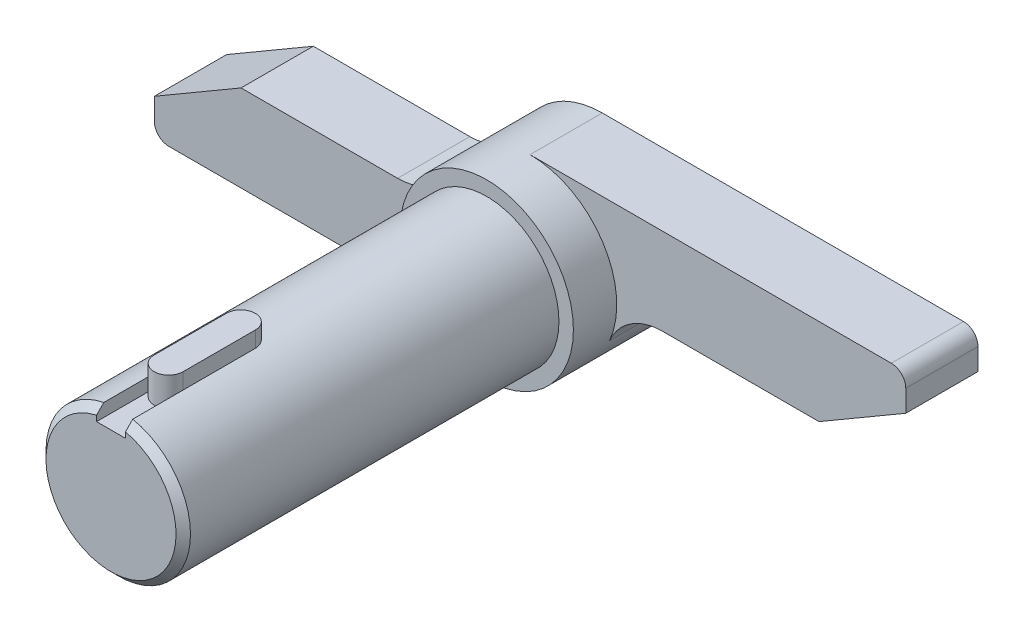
SolidWorks part; units mm, degrees
ref_plane "Plane1" through (0, 0, 0) normal (0, 0, 1) x (1, 0, 0)
ref_plane "Plane2" through (0, 0, 0) normal (0, 1, 0) x (1, 0, 0)
ref_plane "Plane3" through (0, 0, 0) normal (1, 0, 0) x (0, 0, -1)
sketch "Esquisse1" plane through (0, 0, 0) normal (0, 0, 1) x (1, 0, 0)
  line L0 (0, -6) -> (-26, -6)
  line L1 (6, 0) -> (20, 0)
  line L2 (-6, 0) -> (-20, 0)
  line L4 (0, 5.5) -> (0, -18.5) construction
  line L5 (-26, -6) -> (-26, -3.5)
  line L6 (-20, 0) -> (-26, -3.5)
  line L7 (26, 6) -> (26, 3.5)
  line L8 (28, 0) -> (-33.5, 0) construction
  line L12 (26, 6) -> (0, 6)
  line L13 (20, 0) -> (26, 3.5)
  arc A0 (0, 6) -> (-6, 0) centre (0, 0) ccw
  arc A1 (0, -6) -> (6, 0) centre (0, 0) ccw
  point P10 (0, -6)
extrude "Base-Extrusion" add sketch "Esquisse1" along normal blind 5
sketch "Esquisse2" plane through (0, 0, 5) normal (0, 0, 1) x (1, 0, 0)
  circle A0 centre (0, 0) radius 6
extrude "Boss.-Extru.1" add sketch "Esquisse2" along normal blind 3
sketch "Esquisse3" plane through (0, 0, 8) normal (0, 0, 1) x (1, 0, 0)
  circle A0 centre (0, 0) radius 5
extrude "Boss.-Extru.2" add sketch "Esquisse3" along normal blind 26
chamfer "Chanfrein1" distance 0.5 angle 45
sketch "Esquisse5" plane through (0, 0, 34) normal (0, 0, 1) x (1, 0, 0)
  line L0 (-1, 5.5) -> (1.0014, 5.5)
  line L1 (-1, 5.5) -> (-1, 4)
  line L2 (1.0014, 4) -> (-1, 4)
  line L3 (1.0014, 4) -> (1.0014, 5.5)
extrude "Enlèv. mat.-Extru.1" cut sketch "Esquisse5" against normal blind 9
sketch "Esquisse6" plane through (0, 4, 0) normal (0, 1, 0) x (-1, 0, 0)
  line L0 (0, 33.5) -> (0, 34) construction
  circle A0 centre (0, 25.0075) radius 1
extrude "Enlèv. mat.-Extru.2" cut sketch "Esquisse6" along normal blind 3
sketch "Esquisse7" plane through (0, 4, 0) normal (0, 1, 0) x (-1, 0, 0)
  line L0 (1, 25.015) -> (1, 30.0132)
  line L1 (1, 33.5) -> (1, 25.015) construction
  line L2 (-1.0014, 25) -> (-1, 30.0134)
  line L4 (0, 25) -> (0, 8) construction
  arc A0 (1, 25.015) -> (-1.0014, 25) centre (-0.0007, 25.015) cw
  arc A1 (1, 30.0132) -> (-1, 30.0134) centre (0, 30.0132) ccw
extrude "Boss.-Extru.3" add sketch "Esquisse7" along normal blind 2
fillet "Congé1" radius 4
fillet "Congé2" radius 1
